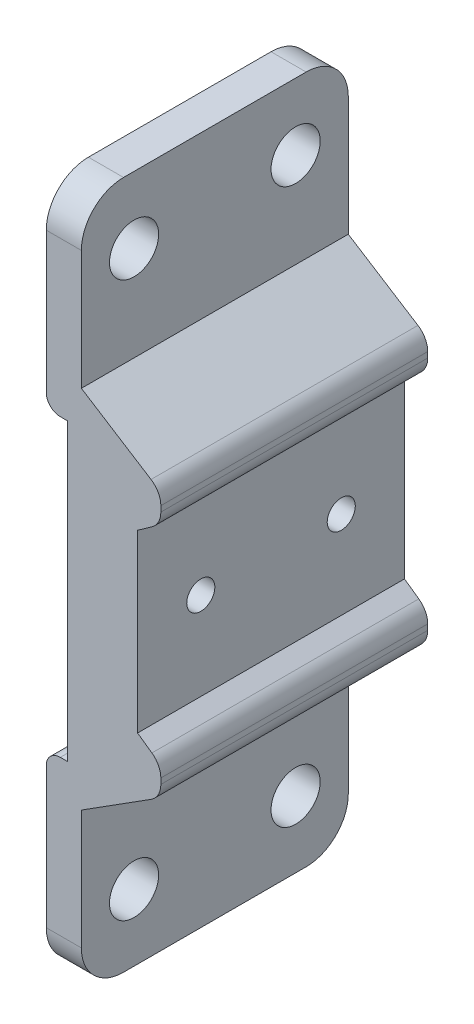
SolidWorks part; units mm, degrees
ref_plane "Face" through (0, 0, 0) normal (0, 0, 1) x (1, 0, 0)
ref_plane "Dessus" through (0, 0, 0) normal (0, 1, 0) x (1, 0, 0)
ref_plane "Droite" through (0, 0, 0) normal (1, 0, 0) x (0, 0, -1)
sketch "Esquisse1" plane through (0, 0, 0) normal (0, 0, 1) x (1, 0, 0)
  line L0 (0, 76.9198) -> (0, -72.0181) construction
  line L1 (-23.5661, 0) -> (72.5837, 0) construction
  line L2 (3, 70.1328) -> (3, -72.0181) construction
  line L3 (0, 49) -> (5, 49)
  line L4 (5, 49) -> (5, 26)
  line L5 (5, 26) -> (14.9169, 19.7193)
  line L6 (16.3117, 17.1848) -> (16.3117, 16.3911)
  line L7 (15.0409, 13.9395) -> (13, 12.5)
  line L8 (13, 12.5) -> (13, -12.5)
  line L9 (3, -21) -> (3, 21)
  line L10 (3, 21) -> (0, 21)
  line L11 (0, 21) -> (0, 49)
  line L12 (15.0409, -13.9395) -> (13, -12.5)
  line L13 (16.3117, -17.1848) -> (16.3117, -16.3911)
  line L14 (5, -26) -> (14.9169, -19.7193)
  line L15 (5, -49) -> (5, -26)
  line L16 (0, -49) -> (5, -49)
  line L17 (0, -21) -> (0, -49)
  line L18 (3, -21) -> (0, -21)
  arc A0 (16.3117, 17.1848) -> (14.9169, 19.7193) centre (13.3117, 17.1848) ccw
  arc A1 (16.3117, 16.3911) -> (15.0409, 13.9395) centre (13.3117, 16.3911) cw
  arc A2 (16.3117, -16.3911) -> (15.0409, -13.9395) centre (13.3117, -16.3911) ccw
  arc A3 (16.3117, -17.1848) -> (14.9169, -19.7193) centre (13.3117, -17.1848) cw
  point P19 (16.3117, 18.8359)
  point P22 (16.3117, 14.8359)
  point P30 (13, 0)
  point P35 (3, 0)
  dimension "D9" = 3
  dimension "D10" = 3
  dimension "D1" = 3
  dimension "D2" = 5
  dimension "D3" = 10
  dimension "D4" = 12.5
  dimension "D5" = 21
  dimension "D6" = 49
  dimension "D7" = 26
  dimension "D8" = 4
extrude "Base-Extrusion" add sketch "Esquisse1" along normal mid plane 38
sketch "Esquisse2" plane through (0, 0, 0) normal (0, 0, 1) x (1, 0, 0)
  line L0 (29.74, 0) -> (-16.471, 0) construction
  line L1 (0, 53.6276) -> (0, -51.9161) construction
  line L2 (3, 21) -> (-3.1592, 16.3545)
  line L4 (7.914, -17.6442) -> (7.914, 17.6442)
  line L5 (7.914, 17.6442) -> (3, 21)
  line L6 (-3.1592, 16.3545) -> (-3.1592, -16.3545)
  line L7 (7.914, -17.6442) -> (3, -21)
  line L8 (3, -21) -> (-3.1592, -16.3545)
  point P9 (-3.1592, 0)
  point P14 (7.914, 0)
extrude "Enlèv. mat.-Extru.1" cut sketch "Esquisse2" against normal mid plane 32
fillet "Congé1" radius 2
sketch "Esquisse3" plane through (0, 0, 0) normal (-1, 0, 0) x (0, 0, 1)
  line L0 (0, 59.589) -> (0, -64.4612) construction
  line L1 (-35.7161, 0) -> (43.259, 0) construction
  circle A0 centre (10, 0) radius 2
  circle A1 centre (11.5, 39.5) radius 3.5
  circle A2 centre (11.5, -39.5) radius 3.5
  circle A3 centre (-11.5, 39.5) radius 3.5
  circle A4 centre (-10, 0) radius 2
  circle A5 centre (-11.5, -39.5) radius 3.5
  dimension "D1" = 4
  dimension "D2" = 7
  dimension "D3" = 7
  dimension "D4" = 11.5
  dimension "D5" = 11.5
  dimension "D6" = 79
  dimension "D7" = 39.5
  dimension "D8" = 10
extrude "Enlèv. mat.-Extru.2" cut sketch "Esquisse3" against normal blind 62
fillet "Congé2" radius 6
